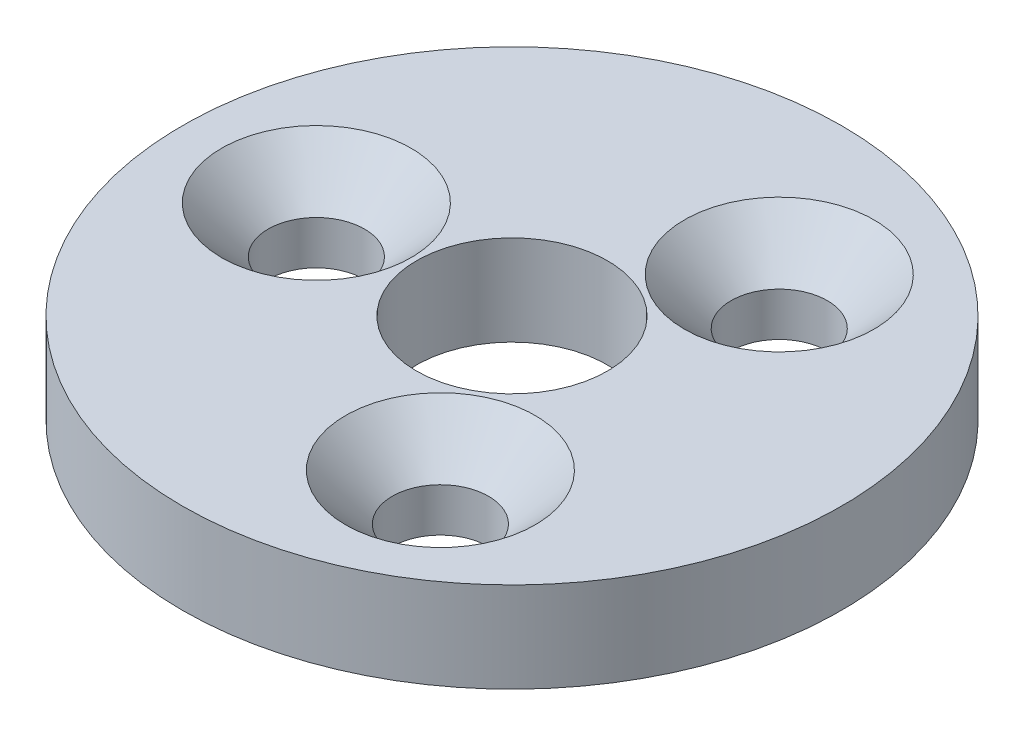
SolidWorks part; units mm, degrees
ref_plane "Front Plane" through (0, 0, 0) normal (0, 0, 1) x (1, 0, 0)
ref_plane "Top Plane" through (0, 0, 0) normal (0, 1, 0) x (1, 0, 0)
ref_plane "Right Plane" through (0, 0, 0) normal (1, 0, 0) x (0, 0, -1)
sketch "Sketch1" plane through (0, 0, 0) normal (0, 1, 0) x (1, 0, 0)
  circle A0 centre (0, 0) radius 10.95
  circle A2 centre (0, 0) radius 3.175
extrude "Boss-Extrude1" add sketch "Sketch1" along normal blind 3
sketch "Sketch5" plane through (0, 3, 0) normal (0, 1, 0) x (1, 0, 0)
  line L0 (0, 0) -> (-10.95, 0) construction
  line L1 (0, 0) -> (5.475, 9.483) construction
  line L2 (0, 0) -> (5.475, -9.483) construction
  circle A0 centre (0, 0) radius 10.95 construction
  circle A1 centre (-6.5, 0) radius 1.5
  circle A2 centre (3.25, 5.6292) radius 1.5
  circle A3 centre (3.25, -5.6292) radius 1.5
  circle A4 centre (0, 0) radius 6.5 construction
hole_wizard "CSK for M3 Countersunk Raised Head Screw1" positions "Sketch2" profile "Sketch4" countersink size "M3" standard "ISO"
sketch "Sketch2" plane through (0, 3, 0) normal (0, 1, 0) x (1, 0, 0)
  point P12 (-6.5, 0)
  point P15 (3.25, 5.6292)
  point P18 (3.25, -5.6292)
sketch "Sketch4" plane through (-6.5, 3, 0) normal (1, 0, 0) x (0, 0, 1)
  line L0 (0, 0) -> (0, 3)
  line L1 (0, 3) -> (1.6, 3)
  line L2 (1.6, 3) -> (1.6, 1.55)
  line L3 (1.6, 1.55) -> (3.15, 0)
  line L5 (3.15, 0) -> (0, 0)
  line L6 (-1.6, 1.55) -> (-3.15, 0) construction
  line L11 (0, -6.35) -> (0, 107.95) construction
  dimension "Thru Hole Dia." = 3.2
  dimension "Thru Hole Depth" = 3
  dimension "Near C'Sink Dia." = 6.3
  dimension "Near C'Sink Angle" = 90
equation "\"D3@Sketch1\"=21.9mm"
equation "\"D4@Sketch1\"=6.35mm"
equation "\"D1@Sketch5\"=120deg"
